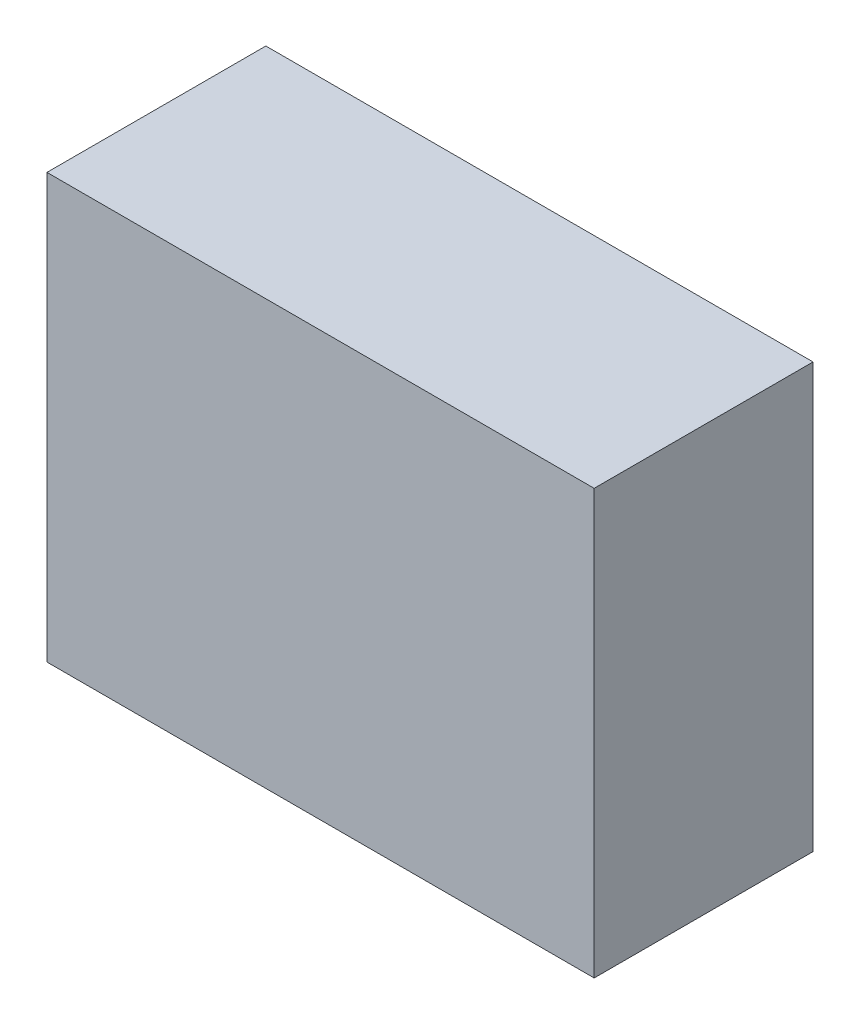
SolidWorks part; units mm, degrees
ref_plane "Plan de face" through (0, 0, 0) normal (0, 0, 1) x (1, 0, 0)
ref_plane "Plan de dessus" through (0, 0, 0) normal (0, 1, 0) x (1, 0, 0)
ref_plane "Plan de droite" through (0, 0, 0) normal (1, 0, 0) x (0, 0, -1)
sketch "Esquisse1" plane through (0, 0, 0) normal (0, 0, 1) x (1, 0, 0)
  line L1 (0, 0) -> (20, 0)
  line L2 (0, 0) -> (0, 15.5)
  line L3 (0, 15.5) -> (20, 15.5)
  line L4 (20, 0) -> (20, 15.5)
  dimension "D1" = 20
  dimension "D2" = 15.5
extrude "Extrusion1" add sketch "Esquisse1" along normal blind 8
